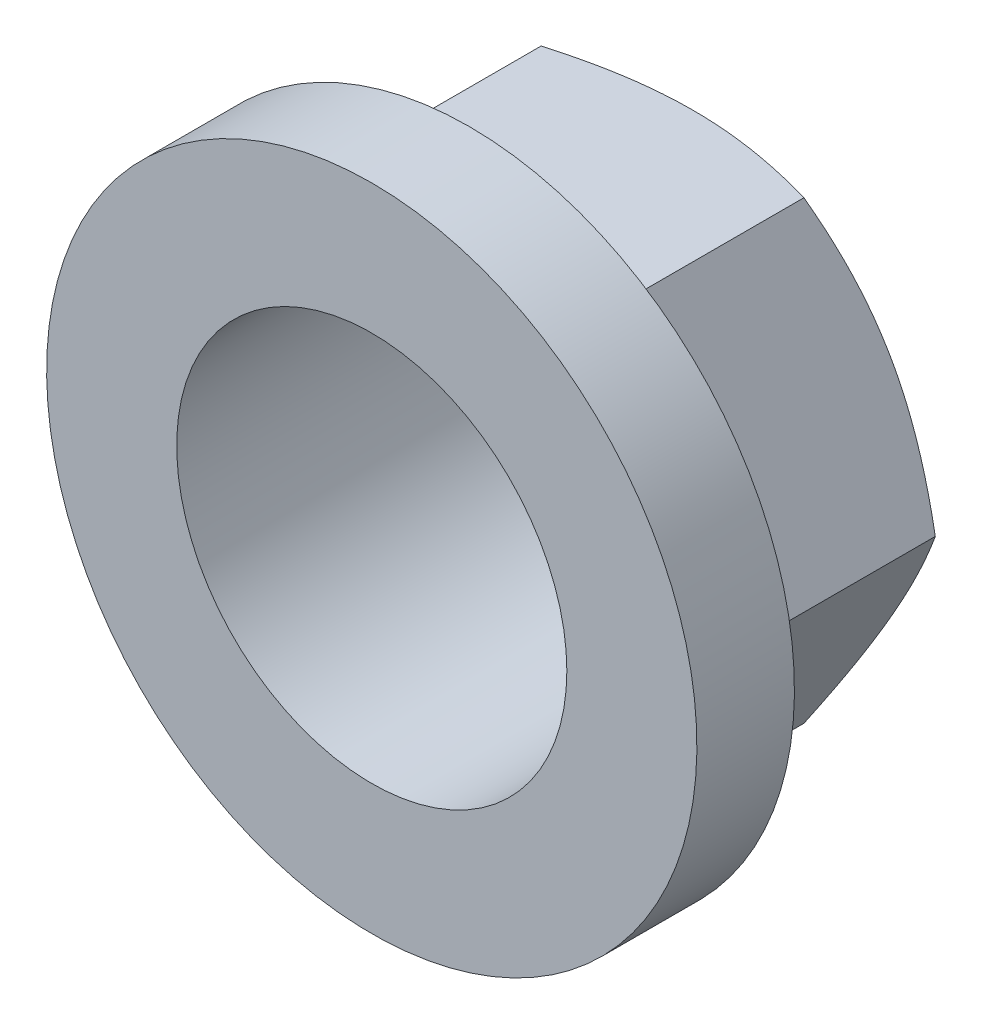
SolidWorks part; units mm, degrees
ref_plane "Plan1" through (0, 0, 0) normal (0, 0, 1) x (1, 0, 0)
ref_plane "Plan2" through (0, 0, 0) normal (0, 1, 0) x (1, 0, 0)
ref_plane "Plan3" through (0, 0, 0) normal (1, 0, 0) x (0, 0, -1)
sketch "Esquisse1" plane through (0, 0, 0) normal (0, 0, 1) x (1, 0, 0)
  line L3 (4.0415, -7) -> (8.0829, 0)
  line L4 (8.0829, 0) -> (4.0415, 7)
  line L5 (4.0415, 7) -> (-4.0415, 7)
  line L6 (-4.0415, 7) -> (-8.0829, 0)
  line L7 (-8.0829, 0) -> (-4.0415, -7)
  line L8 (-4.0415, -7) -> (4.0415, -7)
  circle A0 centre (0, 0) radius 8.0829 construction
  dimension "D3" = 14
extrude "Base-Extrusion" add sketch "Esquisse1" along normal mid plane 7.5
sketch "Esquisse5" plane through (0, 0, 0) normal (1, 0, 0) x (0, 0, -1)
  line L0 (3.75, -7) -> (-3.75, -19.9904)
  line L1 (0, 0) -> (-3.75, 0) construction
  line L2 (-3.75, -7) -> (-3.75, 0) construction
  line L3 (-3.75, -19.9904) -> (3.75, -19.9904)
  line L4 (3.75, -19.9904) -> (3.75, -7)
  line L5 (0, -13.4952) -> (3.75, -19.9904) construction
sketch "Esquisse4" plane through (0, 0, 3.75) normal (0, 0, 1) x (1, 0, 0)
  circle A0 centre (0, 0) radius 4.8
  dimension "D1" = 9.6
extrude "Enlèv. mat.-Extru.1" cut sketch "Esquisse4" against normal through all
revolve "Enlèvement de matière-Révolution1" cut sketch "Esquisse5" angle 360 about L1
mirror "Symétrie1" about plane through (0, 0, 0) normal (0, 0, 1) of "Enlèvement de matière-Révolution1"
sketch "Esquisse6" plane through (0, 0, 0) normal (1, 0, 0) x (0, 0, -1)
  line L0 (0, 0) -> (-31.0154, 0) construction
  line L1 (-3.1248, 0) -> (-6.1248, 0)
  line L2 (-3.1248, 0) -> (-3.1248, 10)
  line L3 (-3.1248, 10) -> (-6.1248, 10)
  line L4 (-6.1248, 0) -> (-6.1248, 10)
  dimension "D1" = 3
  dimension "D2" = 20
revolve "Révolution1" add sketch "Esquisse6" angle 360 about L0
sketch "Esquisse7" plane through (0, 0, 3.1248) normal (0, 0, -1) x (-1, 0, 0)
  circle A1 centre (0, 0) radius 4.8
  circle A2 centre (0, 0) radius 4.8
  dimension "D1" = 0
extrude "Enlèv. mat.-Extru.2" cut sketch "Esquisse7" against normal through all
sketch "Esquisse8" plane through (0, 0, 6.1248) normal (0, 0, 1) x (1, 0, 0)
  circle A0 centre (0, 0) radius 6
  dimension "D1" = 12
extrude "Enlèv. mat.-Extru.3" cut sketch "Esquisse8" against normal through all
equation "\"D1@Esquisse4\" = 0.8*\"D2@Représentation de filetage1\""
